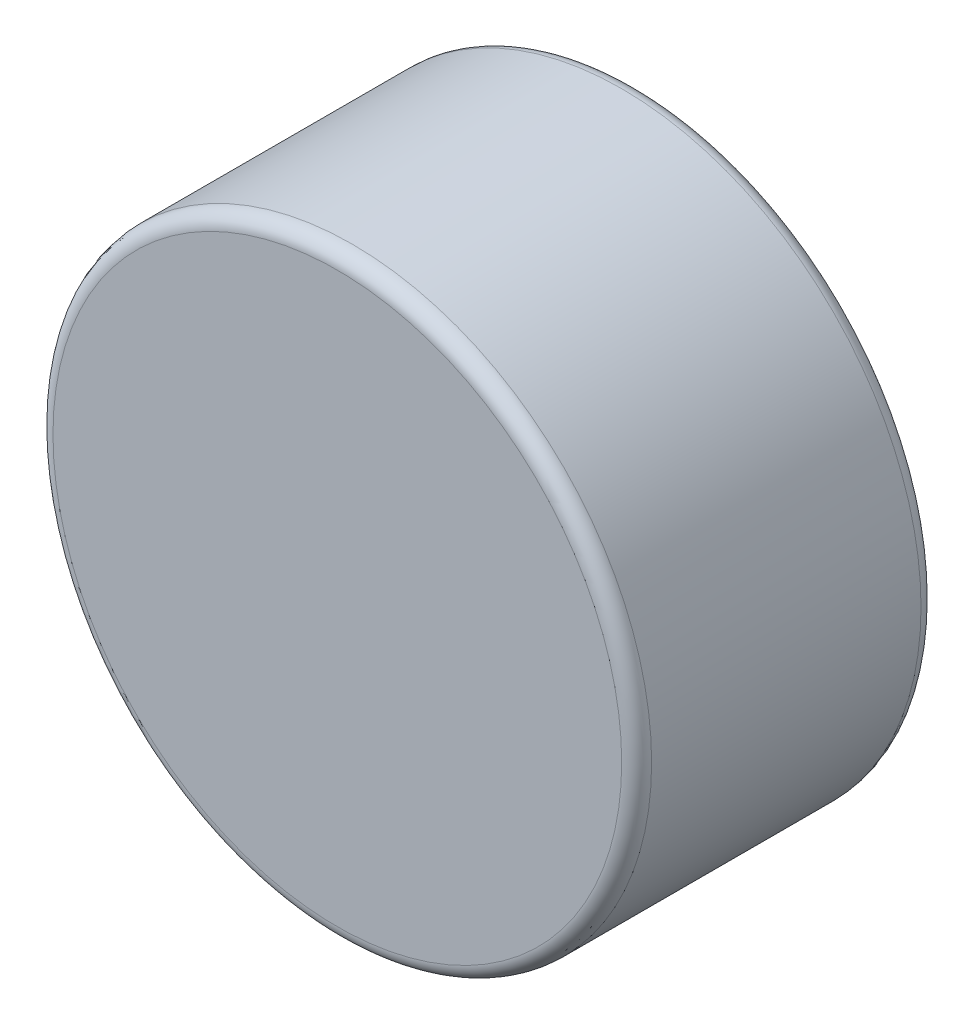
SolidWorks part; units mm, degrees
ref_plane "Спереди" through (0, 0, 0) normal (0, 0, 1) x (1, 0, 0)
ref_plane "Сверху" through (0, 0, 0) normal (0, 1, 0) x (1, 0, 0)
ref_plane "Справа" through (0, 0, 0) normal (1, 0, 0) x (0, 0, -1)
sketch "Эскиз1" plane through (0, 0, 0) normal (0, 0, 1) x (1, 0, 0)
  circle A0 centre (0, 0) radius 10
  dimension "D1" = 20
extrude "Бобышка-Вытянуть1" add sketch "Эскиз1" along normal mid plane 10
fillet "Скругление1" radius 0.5 2 edges at (10, 0, -5) (10, 0, 5)
